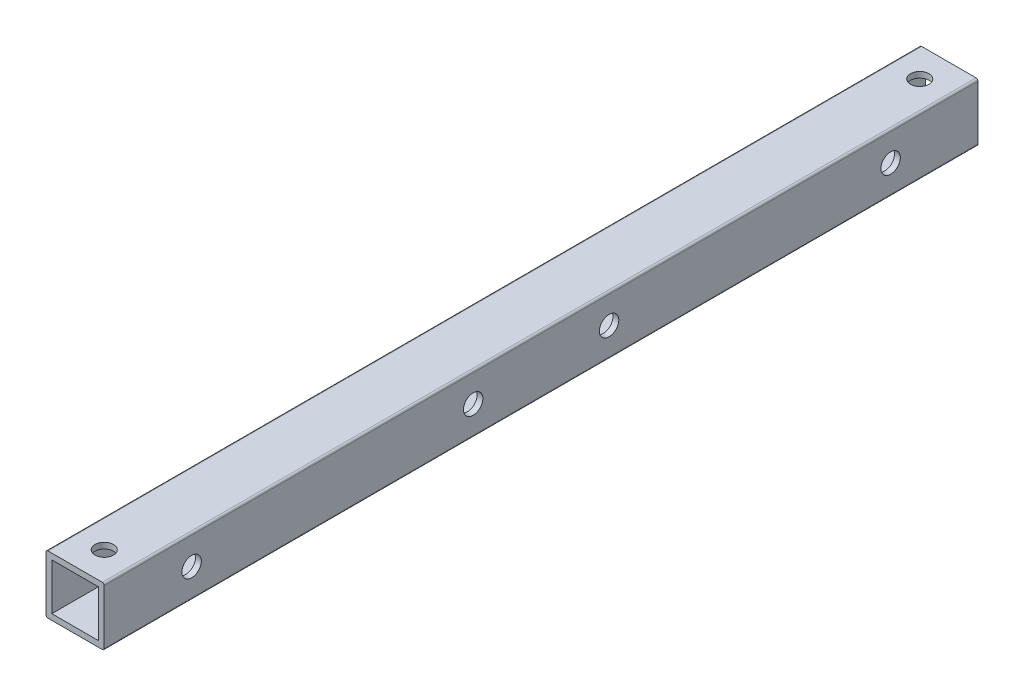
SolidWorks part; units mm, degrees
ref_plane "Plan1" through (0, 0, 0) normal (0, 0, 1) x (1, 0, 0)
ref_plane "Plan2" through (0, 0, 0) normal (0, 1, 0) x (1, 0, 0)
ref_plane "Plan3" through (0, 0, 0) normal (1, 0, 0) x (0, 0, -1)
sketch "Esquisse1" plane through (0, 0, 0) normal (0, 0, 1) x (1, 0, 0)
  line L0 (-14, 15) -> (14, 15)
  line L1 (-15, 14) -> (-15, -14)
  line L2 (14, -15) -> (-14, -15)
  line L3 (15, -14) -> (15, 14)
  line L4 (14, 14) -> (-14, -14) construction
  arc A0 (-14, -15) -> (-15, -14) centre (-14, -14) cw
  arc A1 (-15, 14) -> (-14, 15) centre (-14, 14) cw
  arc A2 (15, 14) -> (14, 15) centre (14, 14) ccw
  arc A3 (15, -14) -> (14, -15) centre (14, -14) cw
  dimension "D1" = 1
  dimension "D2" = 30
extrude "Base-Extru.-Mince" add sketch "Esquisse1" along normal blind 450 thin
sketch "Esquisse5" plane through (-15, 0, 0) normal (-1, 0, 0) x (0, 0, 1)
  line L1 (450, 14) -> (450, -14) construction
  circle A0 centre (405, 0) radius 5
  circle A1 centre (190, 0) radius 5
  circle A2 centre (260, 0) radius 5
  circle A3 centre (45, 0) radius 5
  dimension "D1" = 10
  dimension "D6" = 45
  dimension "D2" = 145
  dimension "D3" = 70
  dimension "D4" = 145
  dimension "D5" = 45
extrude "Enlèv. mat.-Extru.1" cut sketch "Esquisse5" against normal blind 40
sketch "Esquisse6" plane through (0, 15, 0) normal (0, 1, 0) x (-1, 0, 0)
  line L0 (14, 0) -> (-14, 0) construction
  line L1 (14, 450) -> (-14, 450) construction
  circle A0 centre (0, 435) radius 4.75
  circle A1 centre (0, 15) radius 4.75
  dimension "D1" = 9.5
  dimension "D2" = 15
  dimension "D3" = 15
extrude "Enlèv. mat.-Extru.2" cut sketch "Esquisse6" against normal blind 10
